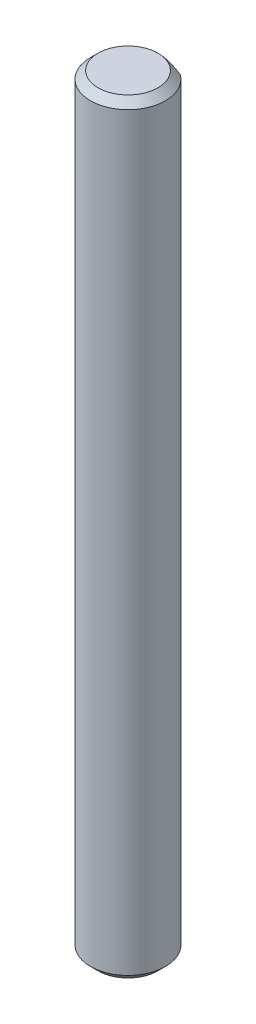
SolidWorks part; units mm, degrees
ref_plane "Спереди" through (0, 0, 0) normal (0, 0, 1) x (1, 0, 0)
ref_plane "Сверху" through (0, 0, 0) normal (0, 1, 0) x (1, 0, 0)
ref_plane "Справа" through (0, 0, 0) normal (1, 0, 0) x (0, 0, -1)
sketch "Эскиз1" plane through (0, 0, 0) normal (0, 1, 0) x (1, 0, 0)
  circle A0 centre (0, 0) radius 2.5
extrude "Бобышка-Вытянуть1" add sketch "Эскиз1" along normal blind 51
sketch "Эскиз2" plane through (0, 51, 0) normal (0, 1, 0) x (1, 0, 0)
  line L0 (0, -2.5) -> (-4.2999, -2.5) construction
  line L1 (-1.5, 2) -> (1.5, 2)
  circle A0 centre (0, 0) radius 2.5 construction
  arc A1 (1.5, 2) -> (-1.5, 2) centre (0, 0) ccw
  dimension "D1" = 4.5
  dimension "D2" = 5
extrude "Вырез-Вытянуть1" cut sketch "Эскиз2" against normal blind 15
chamfer "Фаска1" distance 0.5 angle 45 2 edges at (0, 51, 2.5) (0, 0, 2.5)
